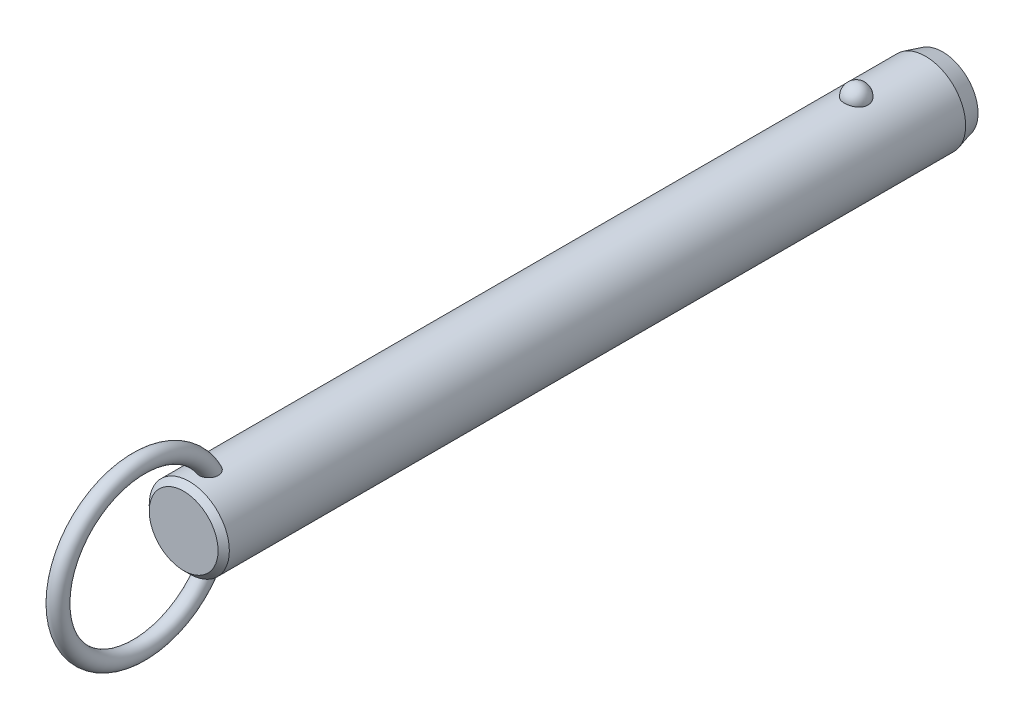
SolidWorks part; units mm, degrees
ref_plane "Front Plane" through (0, 0, 0) normal (0, 0, 1) x (1, 0, 0)
ref_plane "Top Plane" through (0, 0, 0) normal (0, 1, 0) x (1, 0, 0)
ref_plane "Right Plane" through (0, 0, 0) normal (1, 0, 0) x (0, 0, -1)
sketch "Sketch2" plane through (0, 0, 0) normal (0, 0, 1) x (1, 0, 0)
  circle A0 centre (0, 0) radius 7.1
  point P3 (0, 7.1)
  dimension "D1" = 14.2
extrude "Boss-Extrude1" add sketch "Sketch2" along normal blind 109.2
sketch "Sketch3" plane through (0, 0, 0) normal (0, 0, -1) x (-1, 0, 0)
  circle A0 centre (0, 0) radius 7.1
  dimension "D1" = 14.2
extrude "Boss-Extrude2" add sketch "Sketch3" along normal blind 17.4
chamfer "Chamfer1" distance 3 angle 15 1 edges at (-7.1, 0, -17.4)
sketch "Sketch12" plane through (0, 0, 0) normal (1, 0, 0) x (0, 0, -1)
  line L0 (-109.2, 7.1) -> (-109.2, -7.1) construction
  point P0 (-109.2, 0)
sketch "Sketch13" plane through (0, 0, 0) normal (1, 0, 0) x (0, 0, -1)
  circle A0 centre (-125.05, 0) radius 15.85
  point P2 (-109.2, 0)
  dimension "D1" = 31.7
sketch "Sketch14" plane through (0, 0, 0) normal (0, 1, 0) x (1, 0, 0)
  circle A0 centre (0, -110.7) radius 1.5
  point P2 (0, -109.2)
  dimension "D1" = 3
sweep "Sweep1" add profiles "Sketch14" path "Sketch13"
sketch "Sketch15" plane through (0, 0, 109.2) normal (0, 0, 1) x (1, 0, 0)
  circle A0 centre (0, 0) radius 7.1
  dimension "D1" = 14.2
extrude "Boss-Extrude3" add sketch "Sketch15" along normal blind 7.92
chamfer "Chamfer2" distance 1 angle 45 1 edges at (7.1, 0, 117.12)
sketch "Sketch18" plane through (0, 0, 0) normal (1, 0, 0) x (0, 0, -1)
  line L0 (14.4, 7.1) -> (-110.8792, 7.1) construction
  line L1 (2.1, 9.2) -> (2.1, 5)
  line L2 (-110.8792, -7.1) -> (14.4, -7.1) construction
  arc A0 (2.1, 9.2) -> (2.1, 5) centre (2.1, 7.1) ccw
  point P4 (0, 7.1)
  dimension "D1" = 16.3
revolve "Revolve1" add sketch "Sketch18" angle 360 about L1
